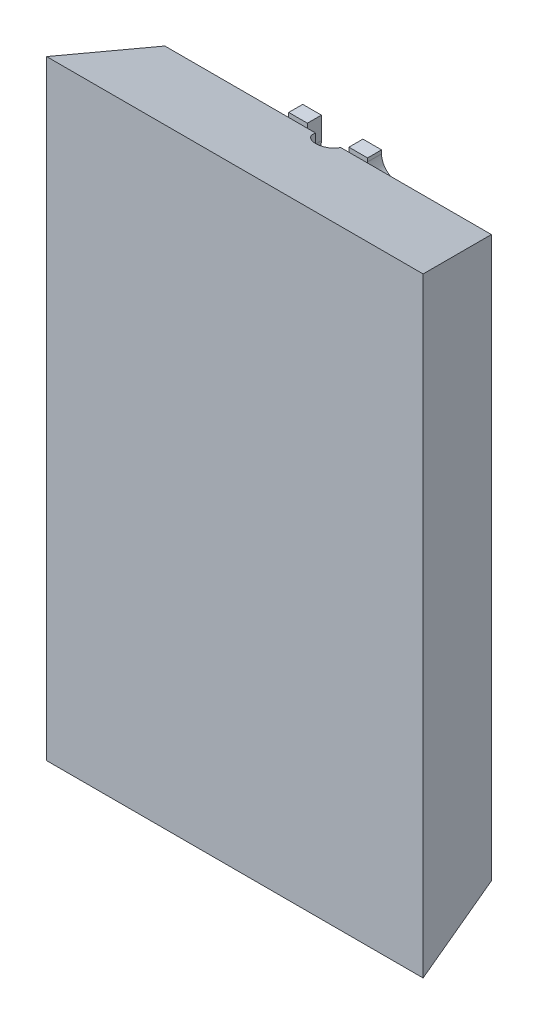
SolidWorks part; units mm, degrees
ref_plane "Front Plane" through (0, 0, 0) normal (0, 0, 1) x (1, 0, 0)
ref_plane "Top Plane" through (0, 0, 0) normal (0, 1, 0) x (1, 0, 0)
ref_plane "Right Plane" through (0, 0, 0) normal (1, 0, 0) x (0, 0, -1)
sketch "Sketch2" plane through (0, 0, 0) normal (0, 0, 1) x (1, 0, 0)
  line L1 (17.5, 55) -> (-17.5, 55)
  line L2 (17.5, 55) -> (17.5, -5)
  line L3 (17.5, -5) -> (-17.5, -5)
  line L4 (-17.5, 55) -> (-17.5, -5)
extrude "Boss-Extrude1" add sketch "Sketch2" along normal blind 10 draft 15
other "Cavity1"
other "Plucker positive<2>@negative_mold"
sketch "Sketch3" plane through (0, 0, 0) normal (0, 0, -1) x (-1, 0, 0)
  line L0 (13.8, 0.5) -> (13.8, 49.5)
  line L1 (-4.225, 55.1) -> (-4.225, 55.4728)
  line L2 (-6.025, 53.3) -> (-13.7, 53.3)
  line L3 (-15.8, -1.2) -> (-15.8, 51.2)
  line L4 (-13.7, -3.3) -> (13.7, -3.3)
  line L24 (17.5, 55) -> (17.5, -5) construction
  line L25 (-17.5, 25) -> (17.5, 25) construction
  line L34 (4.025, 51.3) -> (12, 51.3)
  line L35 (2.225, 53.1) -> (2.225, 55.4728)
  line L46 (-17.5, -5) -> (-17.5, 55) construction
  line L47 (0, -0.8592) -> (0, -1.3) construction
  line L48 (15.8, -1.2) -> (15.8, 51.2)
  line L58 (6.025, 53.3) -> (13.7, 53.3)
  line L59 (4.225, 55.1) -> (4.225, 55.4728)
  line L67 (-4.225, 55.4728) -> (-2.225, 55.4728)
  line L79 (-2.225, 53.1) -> (-2.225, 55.4728)
  line L80 (-4.025, 51.3) -> (-12, 51.3)
  line L81 (-13.8, 0.5) -> (-13.8, 49.5)
  line L86 (-12, -1.3) -> (12, -1.3)
  line L87 (2.225, 55.4728) -> (4.225, 55.4728)
  arc A7 (-15.8, 51.2) -> (-13.7, 53.3) centre (-13.7, 51.2) cw
  circle A10 centre (9.7357, 45.414) radius 2.2583
  arc A27 (-13.7, -3.3) -> (-15.8, -1.2) centre (-13.7, -1.2) cw
  arc A34 (-4.025, 51.3) -> (-2.225, 53.1) centre (-4.025, 53.1) ccw
  arc A35 (-6.025, 53.3) -> (-4.225, 55.1) centre (-6.025, 55.1) ccw
  arc A36 (-13.8, 49.5) -> (-12, 51.3) centre (-12, 49.5) cw
  arc A37 (-12, -1.3) -> (-13.8, 0.5) centre (-12, 0.5) cw
  arc A38 (12, -1.3) -> (13.8, 0.5) centre (12, 0.5) ccw
  arc A39 (13.8, 49.5) -> (12, 51.3) centre (12, 49.5) ccw
  arc A40 (6.025, 53.3) -> (4.225, 55.1) centre (6.025, 55.1) cw
  arc A41 (4.025, 51.3) -> (2.225, 53.1) centre (4.025, 53.1) cw
  arc A42 (13.7, -3.3) -> (15.8, -1.2) centre (13.7, -1.2) ccw
  arc A43 (15.8, 51.2) -> (13.7, 53.3) centre (13.7, 51.2) ccw
  point P45 (0, -2)
  point P50 (0, -3.3)
  point P51 (0, -3)
  dimension "D1" = 1.8
extrude "Boss-Extrude2" add sketch "Sketch3" along normal blind 1.5
equation "\"D3@Sketch2\"=\"D1@Sketch2\"/2"
